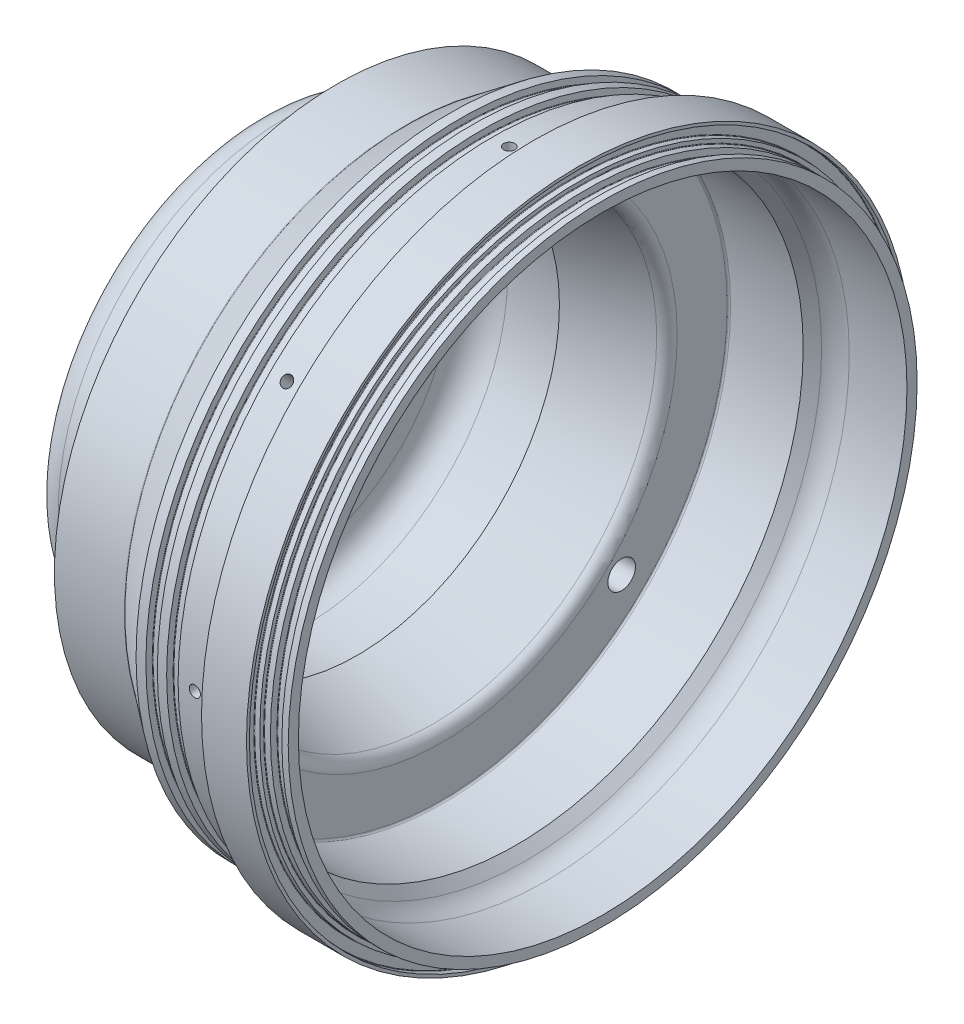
SolidWorks part; units mm, degrees
ref_plane "Front Plane" through (0, 0, 0) normal (0, 0, 1) x (1, 0, 0)
ref_plane "Top Plane" through (0, 0, 0) normal (0, 1, 0) x (1, 0, 0)
ref_plane "Right Plane" through (0, 0, 0) normal (1, 0, 0) x (0, 0, -1)
sketch "Sketch1" plane through (0, 0, 0) normal (0, 0, 1) x (1, 0, 0)
  line L0 (0, 0) -> (58.1311, 0) construction
  line L1 (0, 152.4) -> (0, 144.3609)
  line L2 (0, 143.891) -> (-4.7625, 143.891) construction
  line L3 (-4.7625, 143.891) -> (-4.7625, 152.4)
  line L4 (-4.7625, 152.4) -> (0, 152.4)
  line L5 (0, 144.3609) -> (11.1252, 144.3609)
  line L6 (11.1252, 144.3609) -> (11.1252, 139.7)
  line L7 (11.1252, 139.7) -> (-4.7625, 139.7)
  line L8 (-4.7625, 139.7) -> (-4.7625, 143.891)
  line L9 (0, 144.3609) -> (0, 143.891) construction
  dimension "D2" = 8.509
  dimension "D3" = 4.7625
  dimension "D4" = 304.8
  dimension "D5" = 11.1252
  dimension "D6" = 288.7218
  dimension "D7" = 279.4
revolve "Revolve1" add sketch "Sketch1" angle 360 about L0
sketch "Sketch4" plane through (-4.7625, 0, 0) normal (-1, 0, 0) x (0, 0, 1)
  circle A0 centre (0, 0) radius 139.7 construction
  circle A1 centre (0, 0) radius 152.4
  circle A2 centre (0, 0) radius 152.4
  circle A3 centre (0, 0) radius 139.7
  dimension "D1" = 0
extrude "Boss-Extrude1" add sketch "Sketch4" along normal blind 15.875
sketch "Sketch5" plane through (-20.6375, 0, 0) normal (-1, 0, 0) x (0, 0, 1)
  circle A0 centre (0, 0) radius 139.7 construction
  circle A1 centre (0, 0) radius 139.7
  circle A2 centre (0, 0) radius 144.3609
  dimension "D1" = 288.7218
extrude "Boss-Extrude2" add sketch "Sketch5" along normal blind 38.1
sketch "Sketch2" plane through (0, 0, 0) normal (0, 0, 1) x (1, 0, 0)
  line L0 (0, -152.4) -> (0, 152.4) construction
  line L1 (0, 151.0665) -> (-2.3114, 151.0665)
  line L2 (0, 151.0665) -> (0, 146.304)
  line L3 (0, 146.304) -> (-2.3114, 146.304)
  line L4 (-2.5654, 150.8125) -> (-2.5654, 146.558)
  line L5 (0, 0) -> (-42.8233, 0) construction
  line L6 (-20.6375, 152.4) -> (-20.6375, -152.4) construction
  line L7 (-20.6375, 151.0665) -> (-18.3261, 151.0665) construction
  line L8 (-20.6375, 151.0665) -> (-20.6375, 146.304) construction
  line L9 (-20.6375, 146.304) -> (-18.3261, 146.304) construction
  line L10 (-18.0721, 150.8125) -> (-18.0721, 146.558) construction
  arc A0 (-2.3114, 146.304) -> (-2.5654, 146.558) centre (-2.3114, 146.558) cw
  arc A1 (-2.3114, 151.0665) -> (-2.5654, 150.8125) centre (-2.3114, 150.8125) ccw
  arc A2 (-18.3261, 146.304) -> (-18.0721, 146.558) centre (-18.3261, 146.558) ccw construction
  arc A3 (-18.3261, 151.0665) -> (-18.0721, 150.8125) centre (-18.3261, 150.8125) cw construction
  dimension "D3" = 0.254
  dimension "D5" = 0.254
  dimension "D1" = 2.5654
  dimension "D2" = 4.7625
  dimension "D4" = 292.608
  dimension "D6" = 2.5654
revolve "#2-277" cut sketch "Sketch2" angle 360 about L5
sketch "Sketch3" plane through (0, 0, 0) normal (0, 0, 1) x (1, 0, 0)
  line L0 (8.2024, 144.3609) -> (2.9482, 144.3609)
  line L1 (2.9482, 144.3609) -> (3.1801, 141.7099)
  line L2 (3.4331, 141.478) -> (7.7175, 141.478)
  line L3 (7.9705, 141.7099) -> (8.2024, 144.3609)
  line L4 (7.9502, 141.478) -> (7.9502, 148.0164) construction
  line L5 (3.2004, 141.478) -> (3.2004, 148.0164) construction
  line L6 (11.1252, 144.3609) -> (0, 144.3609) construction
  line L7 (0, 0) -> (37.0915, 0) construction
  line L8 (11.1252, -144.3609) -> (11.1252, 144.3609) construction
  line L9 (-39.4353, 144.3609) -> (-44.6895, 144.3609)
  line L10 (-44.6895, 144.3609) -> (-44.4576, 141.7099)
  line L11 (-44.2046, 141.478) -> (-39.9202, 141.478)
  line L12 (-39.6672, 141.7099) -> (-39.4353, 144.3609)
  line L13 (-39.6875, 141.478) -> (-39.6875, 148.0164) construction
  line L14 (-44.4373, 141.478) -> (-44.4373, 148.0164) construction
  line L15 (-20.6375, 144.3609) -> (-58.7375, 144.3609) construction
  line L16 (-20.6375, 152.4) -> (-20.6375, -152.4) construction
  line L17 (-48.973, 144.3609) -> (-54.2272, 144.3609)
  line L18 (-54.2272, 144.3609) -> (-53.9953, 141.7099)
  line L19 (-53.7423, 141.478) -> (-49.4579, 141.478)
  line L20 (-49.2049, 141.7099) -> (-48.973, 144.3609)
  line L21 (-49.2252, 141.478) -> (-49.2252, 151.0363) construction
  line L22 (-53.975, 141.478) -> (-53.975, 151.0363) construction
  line L23 (-58.7375, 144.3609) -> (-58.7375, -144.3609) construction
  arc A0 (3.1801, 141.7099) -> (3.4331, 141.478) centre (3.4331, 141.732) ccw
  arc A1 (7.7175, 141.478) -> (7.9705, 141.7099) centre (7.7175, 141.732) ccw
  arc A2 (-44.4576, 141.7099) -> (-44.2046, 141.478) centre (-44.2046, 141.732) ccw
  arc A3 (-39.9202, 141.478) -> (-39.6672, 141.7099) centre (-39.9202, 141.732) ccw
  arc A4 (-53.9953, 141.7099) -> (-53.7423, 141.478) centre (-53.7423, 141.732) ccw
  arc A5 (-49.4579, 141.478) -> (-49.2049, 141.7099) centre (-49.4579, 141.732) ccw
  dimension "D4" = 0.254
  dimension "D11" = 0.254
  dimension "D15" = 0.254
  dimension "D1" = 4.7498
  dimension "D2" = 5
  dimension "D3" = 5
  dimension "D5" = 282.956
  dimension "D6" = 3.175
  dimension "D7" = 4.7498
  dimension "D8" = 5
  dimension "D9" = 5
  dimension "D10" = 19.05
  dimension "D12" = 4.7498
  dimension "D13" = 5
  dimension "D14" = 5
  dimension "D16" = 4.7625
  dimension "D17" = 4.7879
revolve "#2-276" cut sketch "Sketch3" angle 360 about L7
sketch "Sketch7" plane through (0, 0, 0) normal (0, 0, 1) x (1, 0, 0)
  line L0 (-101.6, 103.8479) -> (-101.6, 92.8687) construction
  line L1 (-111.125, 103.8542) -> (-134.9375, 103.8542)
  line L2 (-101.6, 92.8687) -> (-125.4125, 92.8687)
  line L3 (-111.125, 103.8542) -> (-111.125, 129.4384)
  line L4 (-101.6, 103.8479) -> (-62.7126, 103.8479) construction
  line L5 (0, 0) -> (-83.6527, 0) construction
  line L6 (-62.7126, 131.7625) -> (-62.7126, 103.8479)
  line L7 (-111.125, 129.4384) -> (-78.7908, 129.4384)
  line L8 (-62.7126, 131.7625) -> (-58.7375, 131.7625)
  line L9 (-58.7375, 144.3609) -> (-58.7375, -144.3609) construction
  line L10 (-78.7908, 129.4384) -> (-58.7375, 144.3609)
  line L11 (-147.6375, 91.1542) -> (-147.6375, 0)
  line L12 (-147.6375, 0) -> (-138.1125, 0)
  line L13 (11.1252, 139.7) -> (-58.7375, 139.7) construction
  line L14 (-20.6375, 139.7) -> (-58.7375, 139.7)
  line L15 (-58.7375, 144.3609) -> (-58.7375, 139.7)
  line L16 (-20.6375, 152.4) -> (-20.6375, -152.4) construction
  line L17 (-20.6375, 139.7) -> (-28.575, 131.7625)
  line L18 (-28.575, 131.7625) -> (-58.7375, 131.7625)
  line L19 (-138.1125, 0) -> (-138.1125, 80.1687)
  line L21 (-101.6, 92.8687) -> (-62.7126, 103.8479)
  arc A0 (-134.9375, 103.8542) -> (-147.6375, 91.1542) centre (-134.9375, 91.1542) ccw
  arc A1 (-138.1125, 80.1687) -> (-125.4125, 92.8687) centre (-125.4125, 80.1687) cw
  dimension "D13" = 12.7
  dimension "D14" = 12.7
  dimension "D1" = 101.6
  dimension "D2" = 9.525
  dimension "D3" = 103.8479
  dimension "D4" = 62.7126
  dimension "D5" = 258.8768
  dimension "D6" = 32.3342
  dimension "D7" = 45
  dimension "D8" = 185.7375
  dimension "D9" = 9.525
  dimension "D10" = 207.7085
  dimension "D11" = 138.1125
  dimension "D12" = 263.525
  dimension "D15" = 144.3609
revolve "Revolve2" add sketch "Sketch7" angle 360 about L5
sketch "Sketch8" plane through (-111.125, 0, 0) normal (-1, 0, 0) x (0, 0, 1)
  line L0 (0, 0) -> (82.5465, 82.5465) construction
  line L1 (0, 0) -> (0, 173.0164) construction
  circle A0 centre (0, 0) radius 116.7384 construction
  circle A1 centre (82.5465, 82.5465) radius 6.35
  circle A2 centre (82.5465, -82.5465) radius 6.35
  circle A3 centre (-82.5465, -82.5465) radius 6.35
  circle A4 centre (-82.5465, 82.5465) radius 6.35
  point P15 (0, 0)
  dimension "D2" = 233.4768
  dimension "D3" = 12.7
  dimension "D1" = 45
  dimension "D4" = 4
extrude "Cut-Extrude1" cut sketch "Sketch8" against normal through all
sketch "Tube Shell" plane through (0, 0, 0) normal (0, 0, 1) x (1, 0, 0)
  line L0 (0, 0) -> (-5.9636, 0) construction
  line L1 (-20.6629, 152.4) -> (-720.7123, 152.4)
  line L2 (-111.125, 88.8965) -> (-111.125, 76.1965) construction
  line L3 (-21.3608, 144.399) -> (-720.7123, 144.399)
  line L4 (-720.7123, 152.4) -> (-720.7123, 144.399)
  line L5 (-20.6629, 144.653) -> (-20.6629, 152.4)
  line L6 (-20.6375, 152.4) -> (-20.6375, -152.4) construction
  line L7 (-20.6629, 144.653) -> (-21.3608, 144.399)
  point P0 (-20.6629, 152.4)
  dimension "D1" = 144.399
  dimension "D2" = 152.4
  dimension "D3" = 0.0254
  dimension "D4" = 0.254
  dimension "D5" = 20
  dimension "D6" = 700.0494
  dimension "D7" = 609.5873
ref_plane "Plane1" through (-31.75, 0, 0) normal (1, 0, 0) x (0, 0, -1)
revolve "Tube" [suppressed] add sketch "Tube Shell" angle 360 about L0
sketch "Sketch9" plane through (-31.75, 0, 0) normal (1, 0, 0) x (0, 0, -1)
  line L0 (0, 152.4) -> (0, 163.2313) construction
  line L1 (0, 152.4) -> (6.7437, 152.4)
  line L2 (6.7437, 152.4) -> (3.3782, 148.5284)
  line L3 (3.3782, 148.5284) -> (3.3782, 144.2879)
  line L4 (2.5952, 134.9375) -> (0, 133.3782)
  line L5 (0, 133.3782) -> (0, 152.4)
  line L6 (2.5952, 134.9375) -> (2.5952, 144.2879)
  line L7 (2.5952, 144.2879) -> (3.3782, 144.2879)
  dimension "D1" = 5.1904
  dimension "D2" = 13.4874
  dimension "D3" = 41
  dimension "D4" = 59
  dimension "D5" = 6.7564
  dimension "D6" = 8.1121
  dimension "D7" = 17.4625
revolve "1/4 CNTR SINK" [suppressed] cut sketch "Sketch9" angle 360 about L0
ref_plane "Plane2" [suppressed] through (-709.5998, 0, 0) normal (-1, 0, 0) x (0, 0, 1)
sketch "Sketch10" [suppressed] plane through (-709.5998, 0, 0) normal (-1, 0, 0) x (0, 0, 1)
  line L0 (0, 0) -> (0, 137.9509) construction
  line L1 (0, 152.4) -> (-6.7462, 152.4)
  line L2 (-6.7462, 152.4) -> (-3.3782, 148.5255)
  line L3 (-3.3782, 148.5255) -> (-3.3782, 144.3595)
  line L4 (-3.3782, 144.3595) -> (0, 144.3595)
  line L5 (0, 144.3595) -> (0, 152.4)
  circle A0 centre (0, 0) radius 152.4 construction
  circle A2 centre (0, 0) radius 144.399 construction
  dimension "D1" = 6.7564
  dimension "D2" = 13.4925
  dimension "D3" = 41
revolve "1/4 CNTR SINK 2 Cut-Revolve1" [suppressed] cut sketch "Sketch10" angle 360 about L0
pattern_circular "CirPattern1" [suppressed] count 8 over 360
sketch "Sketch11" plane through (0, 0, 0) normal (0, 0, 1) x (1, 0, 0)
  line L0 (-29.1973, 144.3609) -> (-29.1973, 135.6297)
  line L1 (-29.1973, 135.6297) -> (-31.75, 134.0958)
  line L2 (-31.75, 144.3609) -> (-31.75, 134.0958)
  line L4 (-31.75, 144.3609) -> (-29.1973, 144.3609)
  line L5 (-31.75, 134.0958) -> (-31.75, 151.4762) construction
  line L8 (-31.75, -167.64) -> (-31.75, 167.64) construction
  dimension "D1" = 5.1054
  dimension "D2" = 59
  dimension "D3" = 8.7312
  dimension "D4" = 144.3609
revolve "Cut-Revolve2" cut sketch "Sketch11" angle 360 about L2
pattern_circular "CirPattern2" count 8 over 360 of "Cut-Revolve2"
fillet "Fillet1" radius 5.5563 1 edges at (-62.7126, 0, -103.8479)
fillet "Fillet2" radius 12.7 1 edges at (-20.6375, 0, -139.7)
fillet "Fillet4" radius 0.7937 3 edges at (-62.7126, 0, -131.7625) (-111.125, 0, -103.8542) (-78.7908, 0, -129.4384)
fillet "Fillet5" radius 0.254 2 edges at (0, 0, 144.3609) (-20.6375, 0, 144.3609)
sketch "Sketch12" plane through (-138.1125, 0, 0) normal (1, 0, 0) x (0, 0, -1)
  circle A0 centre (0, 44.45) radius 25.4
  dimension "D1" = 50.8
  dimension "D2" = 44.45
extrude "Boss-Extrude3" add sketch "Sketch12" along normal blind 9.525
fillet "Fillet3" radius 4.7625 1 edges at (-138.1125, 44.45, -25.4)
sketch "#2-029" plane through (0, 0, 0) normal (0, 0, 1) x (1, 0, 0)
  line L0 (-147.6375, 63.5254) -> (-142.0812, 63.5254)
  line L1 (-142.0812, 63.5254) -> (-142.0812, 64.77)
  line L2 (-142.0812, 64.77) -> (-139.719, 64.77)
  line L3 (-139.719, 64.77) -> (-139.719, 63.5254)
  line L4 (-139.719, 63.5254) -> (-136.1313, 63.5254)
  line L5 (-136.1313, 63.5254) -> (-136.1313, 60.3504)
  line L6 (-136.1313, 60.3504) -> (-125.4125, 60.3504)
  line L7 (-125.4125, 92.8687) -> (-125.4125, -92.8687) construction
  line L8 (-125.4125, 60.3504) -> (-125.4125, 44.45)
  line L9 (-125.4125, 44.45) -> (-147.6375, 44.45)
  line L10 (-147.6375, 44.45) -> (-147.6375, 63.5254)
  line L11 (-147.6375, 91.1542) -> (-147.6375, -91.1542) construction
  line L12 (0, 0) -> (-122.9116, 0) construction
  line L13 (-147.6375, 44.45) -> (-165.1173, 44.45) construction
  dimension "D1" = 38.1508
  dimension "D2" = 11.5062
  dimension "D3" = 10.7188
  dimension "D4" = 31.8008
  dimension "D5" = 2.3622
  dimension "D6" = 40.64
  dimension "D7" = 5.5562
  dimension "D8" = 44.45
revolve "Impulse Cut" cut sketch "#2-029" angle 360 about L13
sketch "Sketch15" plane through (-136.1313, 0, 0) normal (-1, 0, 0) x (0, 0, 1)
  line L0 (2.3876, 60.3504) -> (2.3876, 43.1716)
  line L1 (-2.3876, 60.3504) -> (-2.3876, 43.1716)
  line L2 (-2.3876, 43.1716) -> (2.3876, 43.1716)
  arc A0 (2.3876, 60.3504) -> (-2.3876, 60.3504) centre (0, 60.3504) ccw
  circle A2 centre (0, 44.45) radius 15.9004 construction
  dimension "D1" = 2.3876
extrude "Cut-Extrude2" cut sketch "Sketch15" against normal through all
sketch "92479A820" plane through (0, 0, 0) normal (0, 0, 1) x (1, 0, 0)
  line L0 (-142.0812, 63.5254) -> (-147.6375, 63.5254) construction
  line L1 (-146.4945, 64.0588) -> (-145.7071, 64.0588)
  line L2 (-146.4945, 64.0588) -> (-146.4945, 63.5254)
  line L3 (-146.4945, 63.5254) -> (-145.7071, 63.5254)
  line L4 (-145.7071, 64.0588) -> (-145.7071, 63.5254)
  line L5 (-146.2547, 44.45) -> (-161.0028, 44.45) construction
  line L6 (-147.6375, 44.45) -> (-142.0812, 44.45) construction
  line L7 (-147.6375, 91.1542) -> (-147.6375, -91.1542) construction
  dimension "D1" = 39.2176
  dimension "D2" = 0.7874
  dimension "D3" = 1.143
revolve "Spring Ring Cut" cut sketch "92479A820" angle 360 about L5
sketch "Sketch14" [suppressed] plane through (0, 0, 0) normal (1, 0, 0) x (0, 0, -1)
  line L0 (0, 162.3011) -> (0, 0)
  line L1 (0, 0) -> (165.7896, 0)
  line L2 (165.7896, 0) -> (165.7896, 158.6464)
  line L3 (165.7896, 158.6464) -> (0, 162.3011)
extrude "FEA Cut" [suppressed] cut sketch "Sketch14" against normal through all and the other way through all flip side to cut
equation "\"Buoyancy\"=\"SW-Volume\"*(\"SW-Density\"-.037062)"
